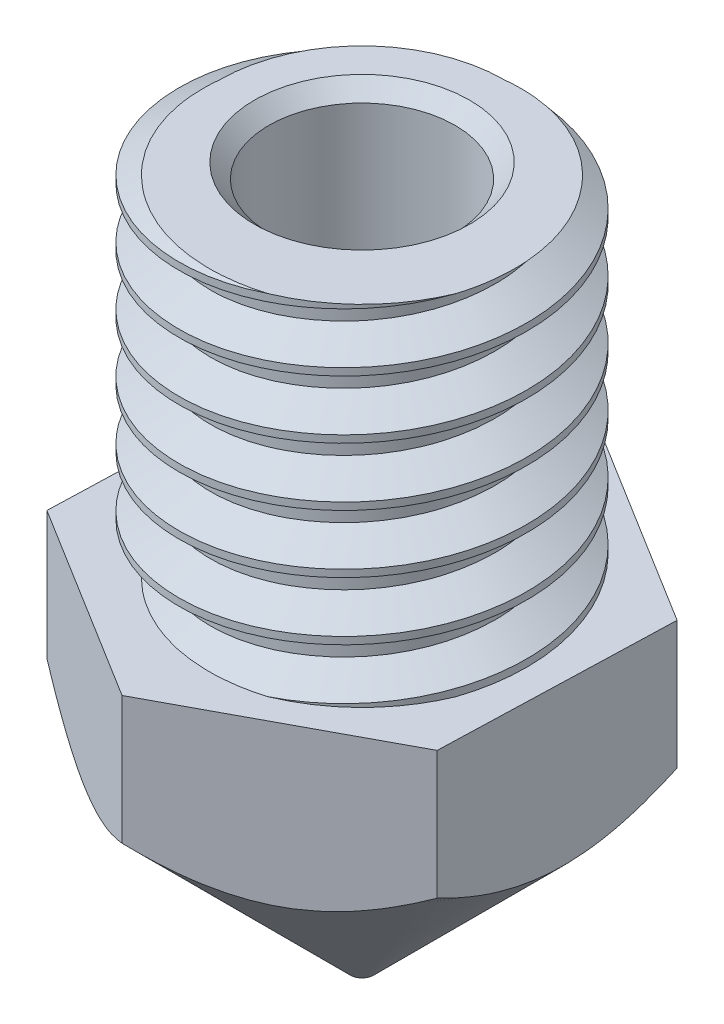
SolidWorks part; units mm, degrees
ref_plane "Front Plane" through (0, 0, 0) normal (0, 0, 1) x (1, 0, 0)
ref_plane "Top Plane" through (0, 0, 0) normal (0, 1, 0) x (1, 0, 0)
ref_plane "Right Plane" through (0, 0, 0) normal (1, 0, 0) x (0, 0, -1)
sketch "Sketch1" plane through (0, 0, 0) normal (1, 0, 0) x (0, 0, -1)
  line L0 (0.2, 0) -> (4, 3.8)
  line L1 (0, 0) -> (0.2, 0) construction
  line L2 (0, 0) -> (0, 12)
  line L3 (0, 12) -> (2.45, 12)
  line L4 (2.45, 6) -> (2.45, 12)
  line L5 (0, 0) -> (0.2, 0) construction
  line L6 (0, 0) -> (0, 6)
  line L7 (0, 6) -> (4, 6)
  line L8 (4, 3.8) -> (4, 6)
  line L9 (0, 0) -> (0.2, 0) construction
  line L10 (0, 0) -> (0, 1.5)
  line L11 (0, 1.5) -> (0.2, 1.5) construction
  line L12 (0.2, 0) -> (0.2, 1.5)
  line L14 (2.45, 0) -> (2.45, 2.25) construction
  line L15 (0.2, 1.5) -> (1.6, 2.9)
  line L16 (0, 1.5) -> (0.2, 1.5) construction
  line L17 (0, 1.5) -> (0, 12)
  line L18 (0, 12) -> (1.6, 12)
  line L19 (1.6, 2.9) -> (1.6, 12)
  line L20 (0.2, 1.5) -> (1.6, 1.5) construction
  line L21 (1.6, 1.5) -> (1.6, 2.9) construction
  line L23 (4, 0) -> (4, 3.8) construction
  line L24 (0.2, 0) -> (2.45, 0) construction
  line L25 (0.2, 0) -> (2.45, 0) construction
  line L26 (2.45, 0) -> (4, 0) construction
  line L27 (2.45, 2.25) -> (2.45, 3.8) construction
  line L28 (2.45, 3.8) -> (4, 3.8) construction
  line L29 (2.45, 3.8) -> (2.45, 6) construction
  point P5 (4.1894, 6)
  point P18 (3.9092, 3.7092)
  point P20 (2.45, 3.8)
  dimension "D1" = 2.45
  dimension "D2" = 12
  dimension "D3" = 6
  dimension "D4" = 1.5
  dimension "D5" = 0.2
  dimension "D6" = 45
  dimension "D7" = 4
  dimension "D8" = 1.6
  dimension "D9" = 1.55
revolve "Revolve1" add sketch "Sketch1" angle 360 about L2
sketch "Sketch2" plane through (0, 6, 0) normal (0, -1, 0) x (1, 0, 0)
  line L1 (3.3996, 2.1077) -> (-0.1255, 3.998)
  line L2 (-0.1255, 3.998) -> (-3.5251, 1.8903)
  line L3 (-3.5251, 1.8903) -> (-3.3996, -2.1077)
  line L4 (-3.3996, -2.1077) -> (0.1255, -3.998)
  line L5 (0.1255, -3.998) -> (3.5251, -1.8903)
  line L6 (3.5251, -1.8903) -> (3.3996, 2.1077)
  circle A0 centre (0, 0) radius 3.4641 construction
  circle A1 centre (0, 0) radius 4 construction
  circle A3 centre (0, 0) radius 4
  dimension "D1" = 0.1255
extrude "Cut-Extrude1" cut sketch "Sketch2" along normal through all contours L4 M14 | L3 M14 | L2 M14 | L1 M14 | L6 M14 | L5 M14
thread "Thread1" pitch 1 start angle 0, offset 1, length 0, pitch 1, diameter 4.9
ref_plane "Plane1" through (-2.45, 13, 0) normal (0, 0, 1) x (-1, 0, 0)
sketch "Thread Profile1" plane through (-2.45, 13, 0) normal (0, 0, 1) x (-1, 0, 0)
  line L0 (0, 0) -> (0, 1) construction
  line L1 (0, 0) -> (0.5413, 0.3125)
  line L2 (0.5413, 0.3125) -> (0.5413, 0.4375)
  line L3 (0.5413, 0.4375) -> (0, 0.75)
  line L4 (0.5413, 0.375) -> (0, 0.375) construction
  line L11 (0, 0) -> (0, 0.75)
  point P2 (0, 0)
  dimension "Pitch" = 1
  dimension "Profile_Angle" = 60
  dimension "Profile_Land" = 0.125
  dimension "Profile_Height" = 0.5413
sketch "Sketch5" plane through (0, 12, 0) normal (0, 1, 0) x (1, 0, 0)
  circle A0 centre (0, 0) radius 8.3785
  dimension "D1" = 16.7571
extrude "Cut-Extrude2" cut sketch "Sketch5" along normal blind 4 contours M3 M2 M4 | M4 | A0 M2 M3
sketch "Sketch6" plane through (-1.6371, 0, -3.0529) normal (-0.4726, 0, -0.8813) x (-0.8813, 0, 0.4726)
  line L0 (-2, 6) -> (-2, 3.8) construction
  line L1 (-2, 6) -> (2, 6) construction
  text T0 "0.4    " font "Century Gothic" height 1.5
  point P1 (-1.9644, 3.6847)
  point P2 (-1.675, 4.1609)
  point P3 (-0.6947, 3.9835)
  point P4 (-1.1802, 3.9275)
  point P5 (-1.4603, 3.9742)
  dimension "D1" = 0.5397
  dimension "D2" = 2.0258
extrude "Cut-Extrude3" cut sketch "Sketch6" against normal blind 0.1
chamfer "Chamfer1" distance 0.25 angle 45 1 edges at (0, 12, -1.6)
